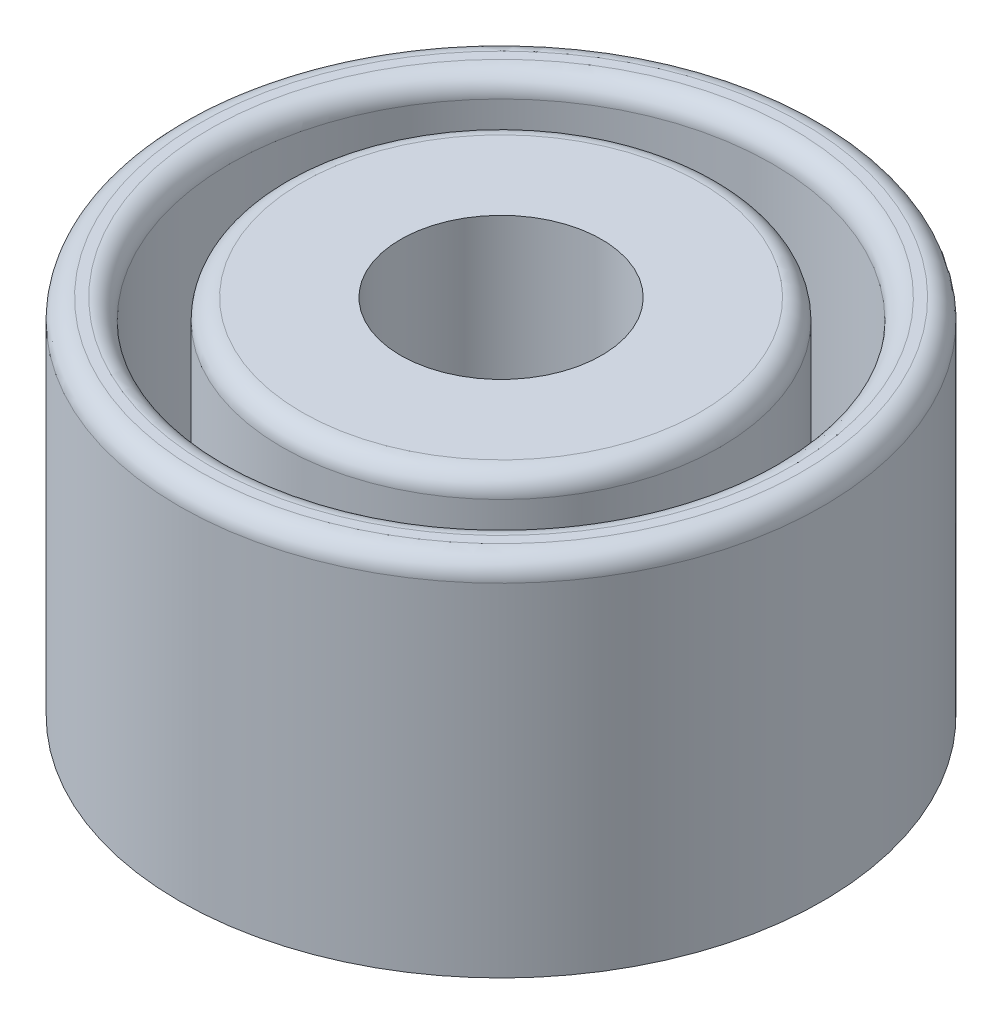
SolidWorks part; units mm, degrees
ref_plane "前基準面" through (0, 0, 0) normal (0, 0, 1) x (1, 0, 0)
ref_plane "上基準面" through (0, 0, 0) normal (0, 1, 0) x (1, 0, 0)
ref_plane "右基準面" through (0, 0, 0) normal (1, 0, 0) x (0, 0, -1)
sketch "草圖1" plane through (0, 0, 0) normal (0, 1, 0) x (1, 0, 0)
  circle A0 centre (0, 0) radius 16
  dimension "D1" = 32
extrude "填料-伸長1" add sketch "草圖1" along normal blind 18
sketch "草圖2" plane through (0, 18, 0) normal (0, 1, 0) x (1, 0, 0)
  circle A0 centre (0, 0) radius 5
  circle A1 centre (0, 0) radius 10.9
  circle A2 centre (0, 0) radius 13.5
  dimension "D1" = 21.8
  dimension "D2" = 27
  dimension "D3" = 10
extrude "除料-伸長1" cut sketch "草圖2" against normal blind 14 contours A0 | A2 A1
sketch "草圖3" plane through (0, 0, 0) normal (0, -1, 0) x (1, 0, 0)
  line L0 (0, -16) -> (0, 16) construction
  line L5 (-16, 0) -> (16, 0) construction
  line L6 (9, -13.2288) -> (9, 13.2288) construction
  circle A0 centre (0, 0) radius 16 construction
  text T0 "<b>NCKU</b>" font "Myanmar Text" height 6
  text T1 "<b>ES</b>" font "Myanmar Text" height 7
  point P8 (0, 0)
  point P11 (9, 0)
  point P12 (0, 0)
  point P13 (0, 0)
  point P15 (0, -14.1452)
  point P16 (0, -16)
  point P17 (9, -13.2288)
  dimension "D1" = 9
extrude "除料-伸長2" cut sketch "草圖3" against normal blind 1
fillet "圓角1" radius 1 3 edges at (0, 18, 16) (0, 18, 13.5) (0, 18, 10.9)
